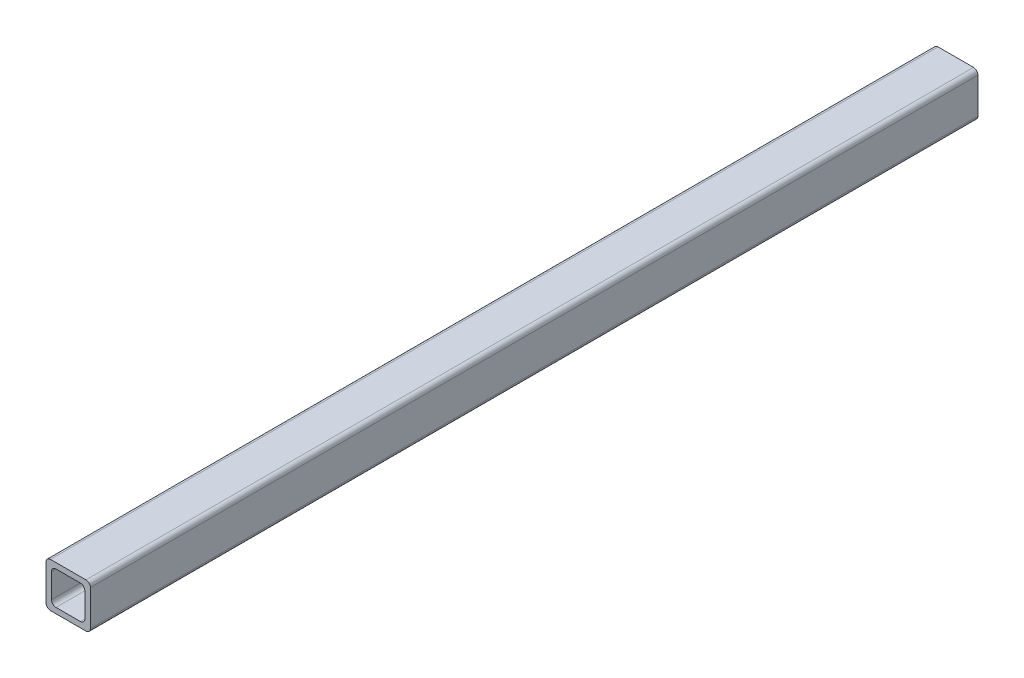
SolidWorks part; units mm, degrees
ref_plane "Plan de face" through (0, 0, 0) normal (0, 0, 1) x (1, 0, 0)
ref_plane "Plan de dessus" through (0, 0, 0) normal (0, 1, 0) x (1, 0, 0)
ref_plane "Plan de droite" through (0, 0, 0) normal (1, 0, 0) x (0, 0, -1)
sketch "Esquisse1" plane through (0, 0, 0) normal (0, 0, 1) x (1, 0, 0)
  line L0 (3.999, 7.5) -> (-7.001, 7.5)
  line L1 (6.499, -10) -> (-9.501, -10)
  line L2 (8.499, -8) -> (8.499, 8)
  line L3 (6.499, 10) -> (-9.501, 10)
  line L4 (-11.501, -8) -> (-11.501, 8)
  line L5 (-9.001, -5.5) -> (-9.001, 5.5)
  line L6 (3.999, -7.5) -> (-7.001, -7.5)
  line L7 (5.999, -5.5) -> (5.999, 5.5)
  line L8 (5.999, -7.5) -> (-9.001, -7.5) construction
  line L9 (5.999, -7.5) -> (5.999, 7.5) construction
  line L10 (-9.001, -7.5) -> (-9.001, 7.5) construction
  line L11 (8.499, -10) -> (-11.501, -10) construction
  line L12 (-11.501, -10) -> (-11.501, 10) construction
  line L13 (8.499, -10) -> (8.499, 10) construction
  line L14 (5.999, 7.5) -> (-9.001, 7.5) construction
  line L15 (8.499, 10) -> (-11.501, 10) construction
  arc A0 (3.999, -7.5) -> (5.999, -5.5) centre (3.999, -5.5) ccw
  arc A1 (-9.001, -5.5) -> (-7.001, -7.5) centre (-7.001, -5.5) ccw
  arc A2 (-9.501, -10) -> (-11.501, -8) centre (-9.501, -8) cw
  arc A3 (6.499, -10) -> (8.499, -8) centre (6.499, -8) ccw
  arc A4 (-7.001, 7.5) -> (-9.001, 5.5) centre (-7.001, 5.5) ccw
  arc A5 (3.999, 7.5) -> (5.999, 5.5) centre (3.999, 5.5) cw
  arc A6 (8.499, 8) -> (6.499, 10) centre (6.499, 8) ccw
  arc A7 (-9.501, 10) -> (-11.501, 8) centre (-9.501, 8) ccw
  point P0 (0, 0)
  point P19 (-11.501, -10)
  dimension "D4" = 2
  dimension "D3" = 2.5
extrude "Boss.-Extru.2" add sketch "Esquisse1" along normal blind 400
